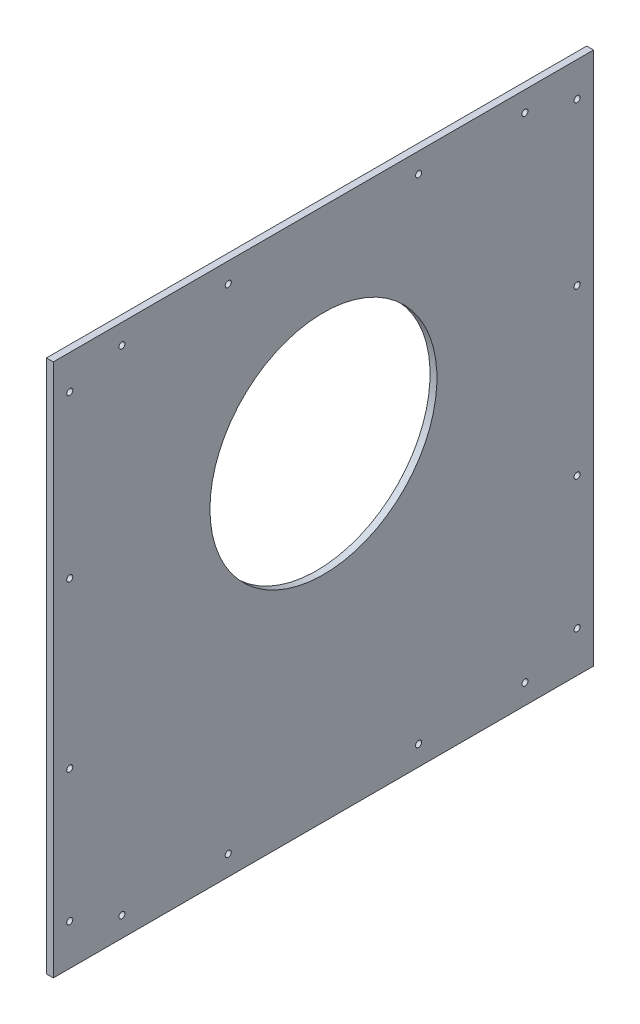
SolidWorks part; units mm, degrees
ref_plane "Front Plane" through (0, 0, 0) normal (0, 0, 1) x (1, 0, 0)
ref_plane "Top Plane" through (0, 0, 0) normal (0, 1, 0) x (1, 0, 0)
ref_plane "Right Plane" through (0, 0, 0) normal (1, 0, 0) x (0, 0, -1)
sketch "Sketch1" plane through (0, 0, 0) normal (1, 0, 0) x (0, 0, -1)
  line L1 (0, 0) -> (499.999, 0)
  line L2 (0, 0) -> (0, 544.576)
  line L3 (0, 544.576) -> (499.999, 544.576)
  line L4 (499.999, 0) -> (499.999, 544.576)
  dimension "D1" = 499.999
  dimension "D2" = 544.576
extrude "Boss-Extrude1" add sketch "Sketch1" along normal blind 6.35
sketch "Sketch2" plane through (6.35, 0, 0) normal (1, 0, 0) x (0, 0, -1)
  line L0 (15.24, -12.8169) -> (15.24, 586.0963) construction
  line L1 (0, 0) -> (0, 550.799) construction
  line L2 (-105.1717, 526.034) -> (532.6565, 526.034) construction
  line L3 (0, 541.274) -> (500.126, 541.274) construction
  line L4 (484.759, 664.8806) -> (484.759, -33.3451) construction
  line L5 (499.999, 0) -> (499.999, 544.576) construction
  line L6 (499.999, 544.576) -> (0, 544.576) construction
  line L7 (249.9995, 0) -> (249.9995, 664.8806) construction
  line L8 (0, 0) -> (499.999, 0) construction
  line L9 (499.999, 0) -> (499.999, 544.576) construction
  circle A0 centre (15.24, 512.826) radius 2.8067
  circle A11 centre (484.759, 512.826) radius 2.8067
  circle A12 centre (63.5, 526.034) radius 2.8067
  circle A13 centre (15.24, 363.474) radius 2.8067
  circle A14 centre (161.925, 526.034) radius 2.8067
  circle A15 centre (338.074, 526.034) radius 2.8067
  circle A16 centre (484.759, 363.474) radius 2.8067
  circle A17 centre (436.499, 526.034) radius 2.8067
  circle A18 centre (484.759, 211.074) radius 2.8067
  circle A19 centre (484.759, 88.6777) radius 2.8067
  circle A20 centre (15.24, 211.074) radius 2.8067
  circle A21 centre (15.24, 88.6777) radius 2.8067
  dimension "D4" = 5.6134
  dimension "D5" = 31.75
  dimension "D6" = 63.5
  dimension "D1" = 15.24
  dimension "D2" = 15.24
  dimension "D3" = 15.24
extrude "Cut-Extrude1" cut sketch "Sketch2" against normal through all
sketch "Sketch3" plane through (0, 0, 0) normal (-1, 0, 0) x (0, 0, 1)
  line L0 (-249.9995, 544.576) -> (-249.9995, 26.3185) construction
  line L1 (-499.999, 544.576) -> (0, 544.576) construction
  circle A0 centre (-249.9995, 354.076) radius 105.029
  dimension "D1" = 210.058
  dimension "D2" = 190.5
extrude "Cut-Extrude2" cut sketch "Sketch3" against normal blind 12.7
sketch "Sketch4" plane through (0, 0, 0) normal (-1, 0, 0) x (0, 0, 1)
  line L0 (0, 544.576) -> (0, 0) construction
  line L1 (-499.999, 0) -> (0, 0)
  line L2 (-499.999, 0) -> (-499.999, 50.8)
  line L3 (-499.999, 50.8) -> (0, 50.8)
  line L4 (0, 0) -> (0, 50.8)
  dimension "D1" = 50.8
extrude "trim for base" cut sketch "Sketch4" against normal through all
sketch "Sketch5" plane through (0, 0, 0) normal (-1, 0, 0) x (0, 0, 1)
  line L0 (0, 50.8) -> (-499.999, 50.8) construction
  line L1 (-499.999, 50.8) -> (-499.999, 544.576) construction
  circle A0 centre (-436.499, 69.342) radius 2.8067
  circle A1 centre (-338.074, 69.342) radius 2.8067
  circle A2 centre (-161.925, 69.342) radius 2.8067
  circle A3 centre (-63.5, 69.342) radius 2.8067
  circle A5 centre (-484.759, 211.074) radius 2.8067 construction
  dimension "D2" = 63.5
  dimension "D1" = 18.542
  dimension "D3" = 161.925
  dimension "D4" = 338.074
  dimension "D5" = 436.499
extrude "Cut-Extrude4" cut sketch "Sketch5" against normal through all
